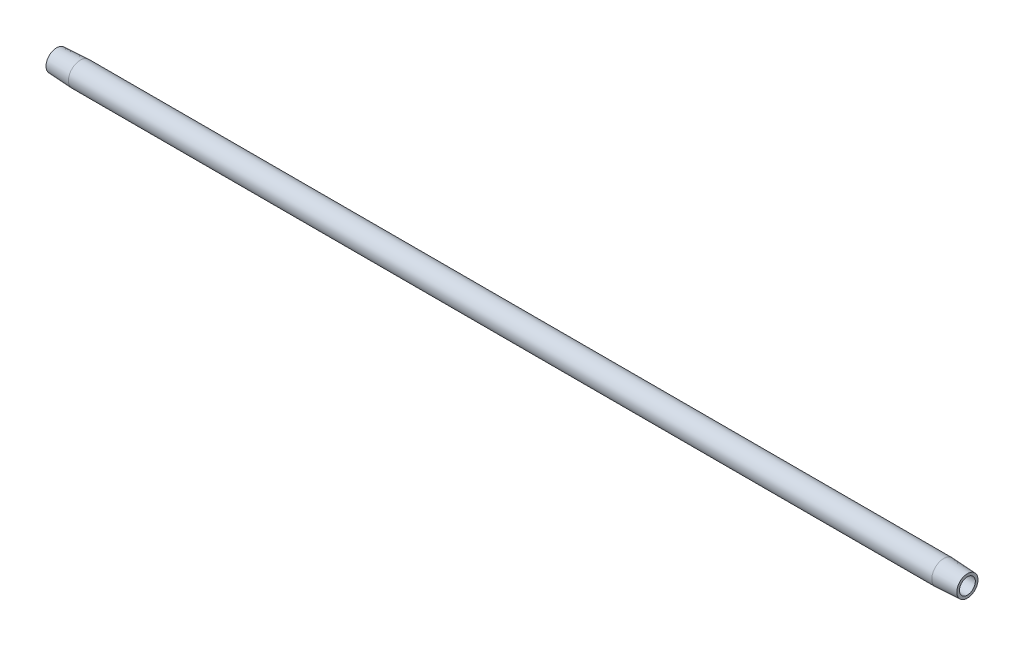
SolidWorks part; units mm, degrees
ref_plane "Front Plane" through (0, 0, 0) normal (0, 0, 1) x (1, 0, 0)
ref_plane "Top Plane" through (0, 0, 0) normal (0, 1, 0) x (1, 0, 0)
ref_plane "Right Plane" through (0, 0, 0) normal (1, 0, 0) x (0, 0, -1)
sketch "Sketch2" plane through (0, 0, 0) normal (0, 0, 1) x (1, 0, 0)
  line L0 (0.4761, 0) -> (50000.4761, 0) construction
  line L1 (0, -11.3625) -> (0, 49988.6375) construction
  line L7 (7.9375, 3.9687) -> (0, 3.5528)
  line L8 (296.8625, 3.9688) -> (7.9375, 3.9687)
  line L9 (304.8, 3.5528) -> (296.8625, 3.9688)
  line L10 (304.8, 2.6543) -> (304.8, 3.5528)
  line L11 (304.8, 2.6543) -> (0, 2.6543)
  line L12 (0, 3.5528) -> (0, 2.6543)
  dimension "D1" = 5.3086
  dimension "D2" = 7.9375
  dimension "D3" = 3
  dimension "D4" = 3
  dimension "D5" = 7.9375
  dimension "D6" = 7.9375
  dimension "D7" = 304.8
revolve "Revolve1" add sketch "Sketch2" angle 360 about L0
